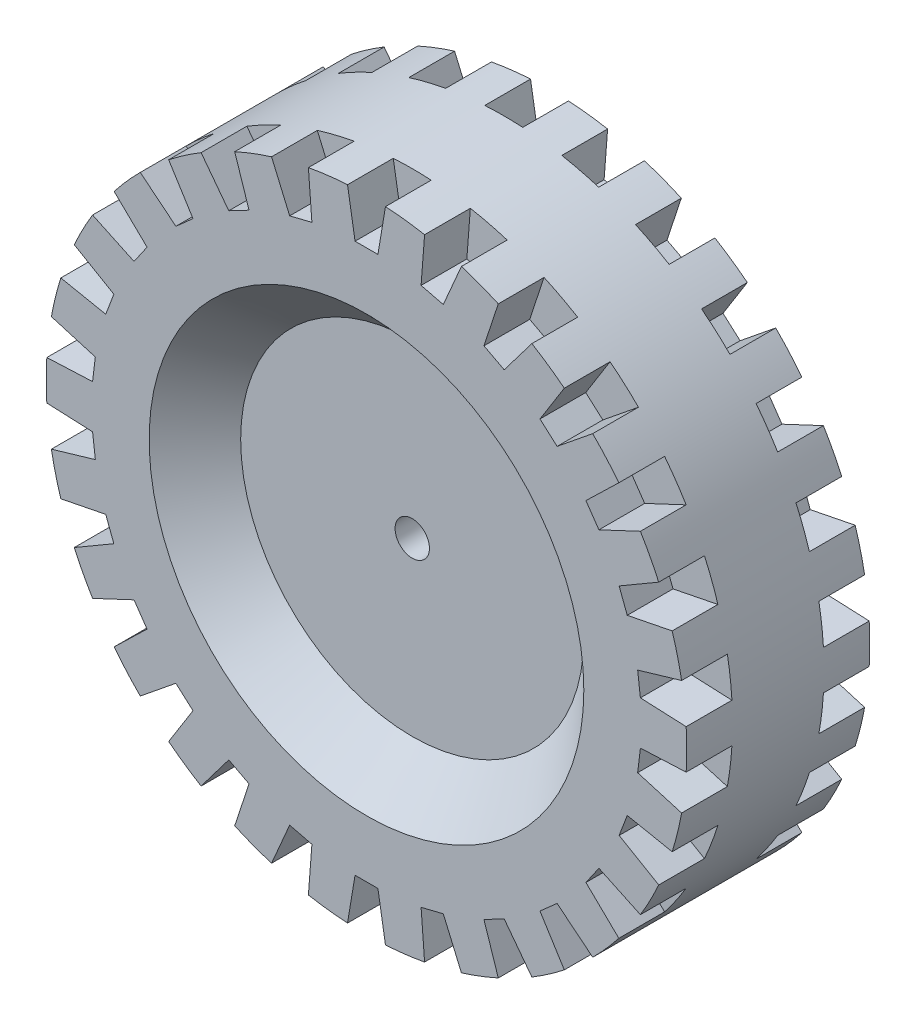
SolidWorks part; units mm, degrees
ref_plane "Front Plane" through (0, 0, 0) normal (0, 0, 1) x (1, 0, 0)
ref_plane "Top Plane" through (0, 0, 0) normal (0, 1, 0) x (1, 0, 0)
ref_plane "Right Plane" through (0, 0, 0) normal (1, 0, 0) x (0, 0, -1)
sketch "Sketch1" plane through (0, 0, 0) normal (0, 0, 1) x (1, 0, 0)
  circle A0 centre (0, 0) radius 1.5
  circle A1 centre (0, 0) radius 28
  dimension "D1" = 3
  dimension "D2" = 56
extrude "Extrude1" add sketch "Sketch1" along normal mid plane 16
sketch "Sketch2" plane through (0, 0, 8) normal (0, 0, 1) x (1, 0, 0)
  circle A0 centre (0, 0) radius 15
  dimension "D1" = 30
extrude "Extrude2" cut sketch "Sketch2" against normal blind 4
chamfer "Chamfer1" distance 4 angle 45 1 edges at (15, 0, 8)
sketch "Sketch3" plane through (0, 0, 8) normal (0, 0, 1) x (1, 0, 0)
  line L0 (0, 0) -> (0, 24.3402) construction
  line L1 (-1, 24) -> (1, 24)
  line L2 (1, 24) -> (2, 30)
  line L3 (2, 30) -> (-2, 30)
  line L4 (-1, 24) -> (-2, 30)
  line L5 (9.1214, 28.6496) -> (5.2376, 29.6069)
  line L6 (4.7726, 23.5419) -> (5.2376, 29.6069)
  line L7 (6.7145, 23.0633) -> (9.1214, 28.6496)
  line L8 (4.7726, 23.5419) -> (6.7145, 23.0633)
  line L9 (15.7126, 25.6342) -> (12.1708, 27.4931)
  line L10 (10.2679, 21.7157) -> (12.1708, 27.4931)
  line L11 (12.0388, 20.7862) -> (15.7126, 25.6342)
  line L12 (10.2679, 21.7157) -> (12.0388, 20.7862)
  line L13 (21.3907, 21.1291) -> (18.3967, 23.7816)
  line L14 (15.1664, 18.6274) -> (18.3967, 23.7816)
  line L15 (16.6635, 17.3011) -> (21.3907, 21.1291)
  line L16 (15.1664, 18.6274) -> (16.6635, 17.3011)
  line L17 (25.8256, 15.396) -> (23.5534, 18.6879)
  line L18 (19.1835, 14.4565) -> (23.5534, 18.6879)
  line L19 (20.3197, 12.8106) -> (25.8256, 15.396)
  line L20 (19.1835, 14.4565) -> (20.3197, 12.8106)
  line L21 (28.7597, 8.7681) -> (27.3413, 12.5082)
  line L22 (22.0858, 9.4455) -> (27.3413, 12.5082)
  line L23 (22.795, 7.5755) -> (28.7597, 8.7681)
  line L24 (22.0858, 9.4455) -> (22.795, 7.5755)
  line L25 (30.0223, 1.6307) -> (29.5402, 5.6015)
  line L26 (23.7045, 3.8856) -> (29.5402, 5.6015)
  line L27 (23.9455, 1.9002) -> (30.0223, 1.6307)
  line L28 (23.7045, 3.8856) -> (23.9455, 1.9002)
  line L29 (29.5402, -5.6015) -> (30.0223, -1.6307)
  line L30 (23.9455, -1.9002) -> (30.0223, -1.6307)
  line L31 (23.7045, -3.8856) -> (29.5402, -5.6015)
  line L32 (23.9455, -1.9002) -> (23.7045, -3.8856)
  line L33 (27.3413, -12.5082) -> (28.7597, -8.7681)
  line L34 (22.795, -7.5755) -> (28.7597, -8.7681)
  line L35 (22.0858, -9.4455) -> (27.3413, -12.5082)
  line L36 (22.795, -7.5755) -> (22.0858, -9.4455)
  line L37 (23.5534, -18.6879) -> (25.8256, -15.396)
  line L38 (20.3197, -12.8106) -> (25.8256, -15.396)
  line L39 (19.1835, -14.4565) -> (23.5534, -18.6879)
  line L40 (20.3197, -12.8106) -> (19.1835, -14.4565)
  line L41 (18.3967, -23.7816) -> (21.3907, -21.1291)
  line L42 (16.6635, -17.3011) -> (21.3907, -21.1291)
  line L43 (15.1664, -18.6274) -> (18.3967, -23.7816)
  line L44 (16.6635, -17.3011) -> (15.1664, -18.6274)
  line L45 (12.1708, -27.4931) -> (15.7126, -25.6342)
  line L46 (12.0388, -20.7862) -> (15.7126, -25.6342)
  line L47 (10.2679, -21.7157) -> (12.1708, -27.4931)
  line L48 (12.0388, -20.7862) -> (10.2679, -21.7157)
  line L49 (5.2376, -29.6069) -> (9.1214, -28.6496)
  line L50 (6.7145, -23.0633) -> (9.1214, -28.6496)
  line L51 (4.7726, -23.5419) -> (5.2376, -29.6069)
  line L52 (6.7145, -23.0633) -> (4.7726, -23.5419)
  line L53 (-2, -30) -> (2, -30)
  line L54 (1, -24) -> (2, -30)
  line L55 (-1, -24) -> (-2, -30)
  line L56 (1, -24) -> (-1, -24)
  line L57 (-9.1214, -28.6496) -> (-5.2376, -29.6069)
  line L58 (-4.7726, -23.5419) -> (-5.2376, -29.6069)
  line L59 (-6.7145, -23.0633) -> (-9.1214, -28.6496)
  line L60 (-4.7726, -23.5419) -> (-6.7145, -23.0633)
  line L61 (-15.7126, -25.6342) -> (-12.1708, -27.4931)
  line L62 (-10.2679, -21.7157) -> (-12.1708, -27.4931)
  line L63 (-12.0388, -20.7862) -> (-15.7126, -25.6342)
  line L64 (-10.2679, -21.7157) -> (-12.0388, -20.7862)
  line L65 (-21.3907, -21.1291) -> (-18.3967, -23.7816)
  line L66 (-15.1664, -18.6274) -> (-18.3967, -23.7816)
  line L67 (-16.6635, -17.3011) -> (-21.3907, -21.1291)
  line L68 (-15.1664, -18.6274) -> (-16.6635, -17.3011)
  line L69 (-25.8256, -15.396) -> (-23.5534, -18.6879)
  line L70 (-19.1835, -14.4565) -> (-23.5534, -18.6879)
  line L71 (-20.3197, -12.8106) -> (-25.8256, -15.396)
  line L72 (-19.1835, -14.4565) -> (-20.3197, -12.8106)
  line L73 (-28.7597, -8.7681) -> (-27.3413, -12.5082)
  line L74 (-22.0858, -9.4455) -> (-27.3413, -12.5082)
  line L75 (-22.795, -7.5755) -> (-28.7597, -8.7681)
  line L76 (-22.0858, -9.4455) -> (-22.795, -7.5755)
  line L77 (-30.0223, -1.6307) -> (-29.5402, -5.6015)
  line L78 (-23.7045, -3.8856) -> (-29.5402, -5.6015)
  line L79 (-23.9455, -1.9002) -> (-30.0223, -1.6307)
  line L80 (-23.7045, -3.8856) -> (-23.9455, -1.9002)
  line L81 (-29.5402, 5.6015) -> (-30.0223, 1.6307)
  line L82 (-23.9455, 1.9002) -> (-30.0223, 1.6307)
  line L83 (-23.7045, 3.8856) -> (-29.5402, 5.6015)
  line L84 (-23.9455, 1.9002) -> (-23.7045, 3.8856)
  line L85 (-27.3413, 12.5082) -> (-28.7597, 8.7681)
  line L86 (-22.795, 7.5755) -> (-28.7597, 8.7681)
  line L87 (-22.0858, 9.4455) -> (-27.3413, 12.5082)
  line L88 (-22.795, 7.5755) -> (-22.0858, 9.4455)
  line L89 (-23.5534, 18.6879) -> (-25.8256, 15.396)
  line L90 (-20.3197, 12.8106) -> (-25.8256, 15.396)
  line L91 (-19.1835, 14.4565) -> (-23.5534, 18.6879)
  line L92 (-20.3197, 12.8106) -> (-19.1835, 14.4565)
  line L93 (-18.3967, 23.7816) -> (-21.3907, 21.1291)
  line L94 (-16.6635, 17.3011) -> (-21.3907, 21.1291)
  line L95 (-15.1664, 18.6274) -> (-18.3967, 23.7816)
  line L96 (-16.6635, 17.3011) -> (-15.1664, 18.6274)
  line L97 (-12.1708, 27.4931) -> (-15.7126, 25.6342)
  line L98 (-12.0388, 20.7862) -> (-15.7126, 25.6342)
  line L99 (-10.2679, 21.7157) -> (-12.1708, 27.4931)
  line L100 (-12.0388, 20.7862) -> (-10.2679, 21.7157)
  line L101 (-5.2376, 29.6069) -> (-9.1214, 28.6496)
  line L102 (-6.7145, 23.0633) -> (-9.1214, 28.6496)
  line L103 (-4.7726, 23.5419) -> (-5.2376, 29.6069)
  line L104 (-6.7145, 23.0633) -> (-4.7726, 23.5419)
  point P9 (0, 24)
  point P10 (0, 30)
  dimension "D1" = 1
  dimension "D2" = 2
  dimension "D3" = 6
  dimension "D4" = 24
extrude "Extrude3" cut sketch "Sketch3" against normal blind 4
mirror "Mirror1" about plane through (0, 0, 0) normal (0, 0, 1) of "Extrude3"
